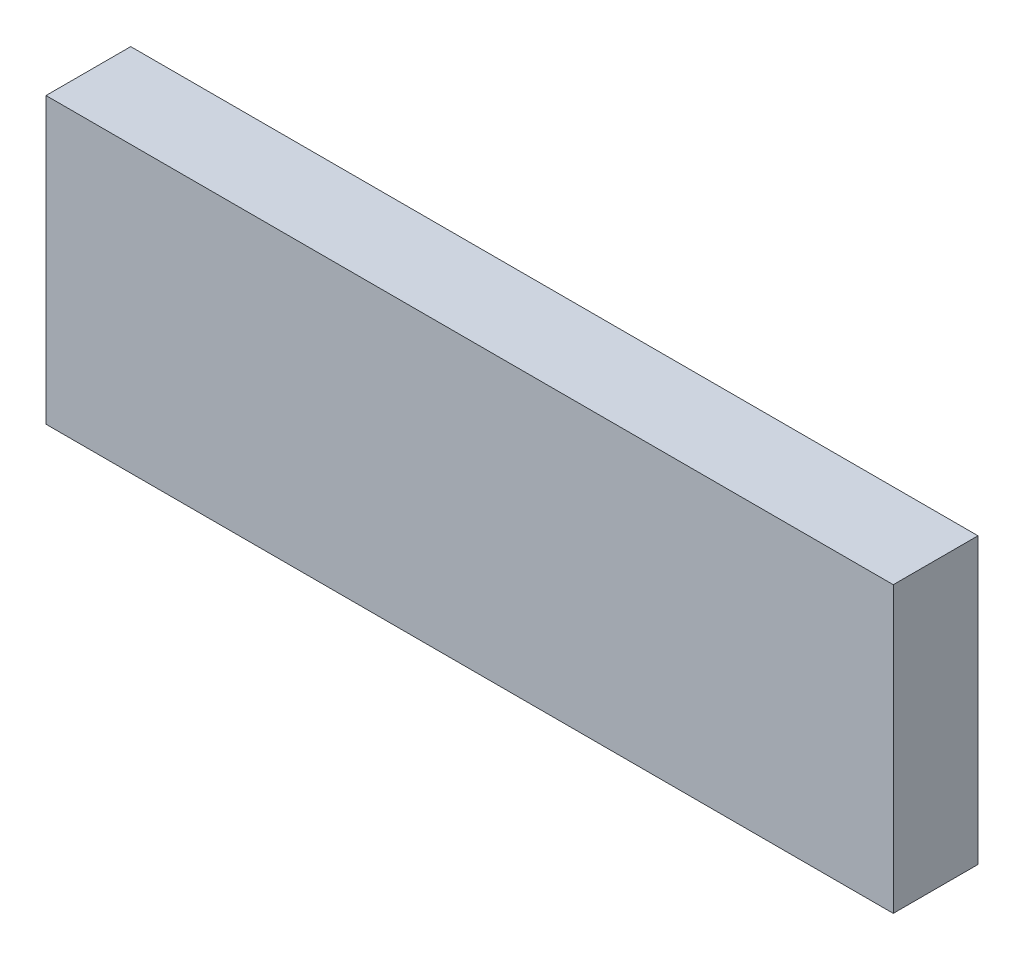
SolidWorks part; units mm, degrees
ref_plane "Front Plane" through (0, 0, 0) normal (0, 0, 1) x (1, 0, 0)
ref_plane "Top Plane" through (0, 0, 0) normal (0, 1, 0) x (1, 0, 0)
ref_plane "Right Plane" through (0, 0, 0) normal (1, 0, 0) x (0, 0, -1)
sketch "Sketch1" plane through (0, 0, 0) normal (0, 0, 1) x (1, 0, 0)
  line L1 (0, 0) -> (31.75, 0)
  line L2 (0, 0) -> (0, 10.668)
  line L3 (0, 10.668) -> (31.75, 10.668)
  line L4 (31.75, 0) -> (31.75, 10.668)
  dimension "D1" = 31.75
  dimension "D2" = 10.668
extrude "Extrude1" add sketch "Sketch1" along normal blind 3.175
